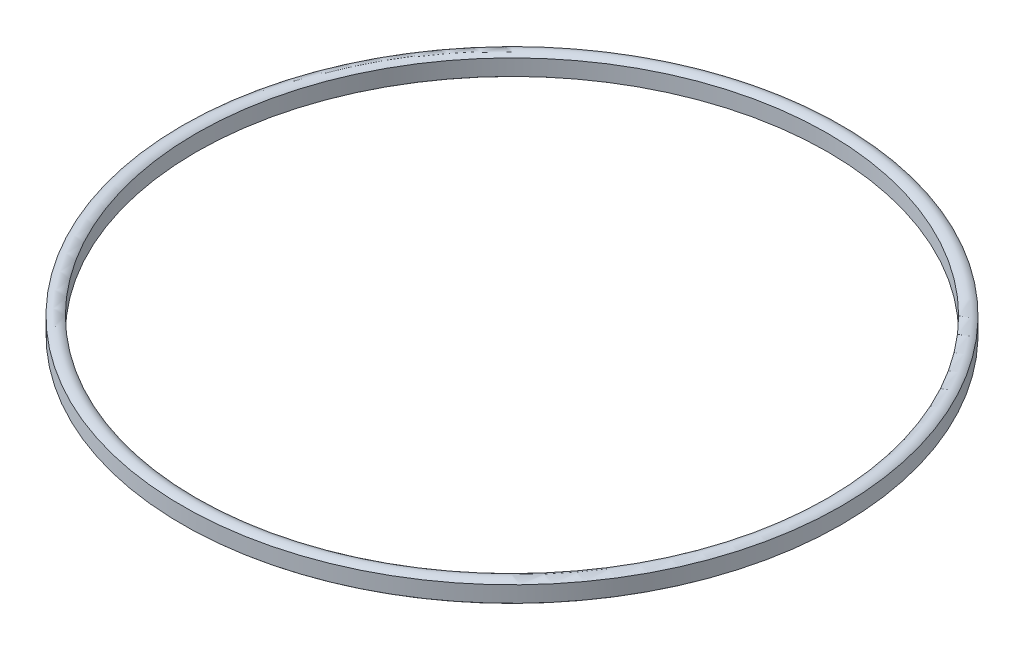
SolidWorks part; units mm, degrees
ref_plane "Front Plane" through (0, 0, 0) normal (0, 0, 1) x (1, 0, 0)
ref_plane "Top Plane" through (0, 0, 0) normal (0, 1, 0) x (1, 0, 0)
ref_plane "Right Plane" through (0, 0, 0) normal (1, 0, 0) x (0, 0, -1)
sketch "Sketch2" plane through (0, 0, 0) normal (0, 0, 1) x (1, 0, 0)
  line L1 (-30.55, 0) -> (0, 0) construction
  line L2 (0, 10.4697) -> (0, -10.4697) construction
  line L3 (-31.2, 1) -> (-29.9, 1)
  line L4 (-31.2, 1) -> (-31.2, -1)
  line L5 (-31.2, -1) -> (-29.9, -1)
  line L6 (-29.9, 1) -> (-29.9, -1)
  circle A0 centre (-30.55, 0) radius 1
  point P5 (0, 0)
  point P11 (-30.55, 1)
  dimension "D1" = 61.1
  dimension "D3" = 1.3
  dimension "D2" = 2
revolve "Revolve2" add sketch "Sketch2" angle 360 about L2
